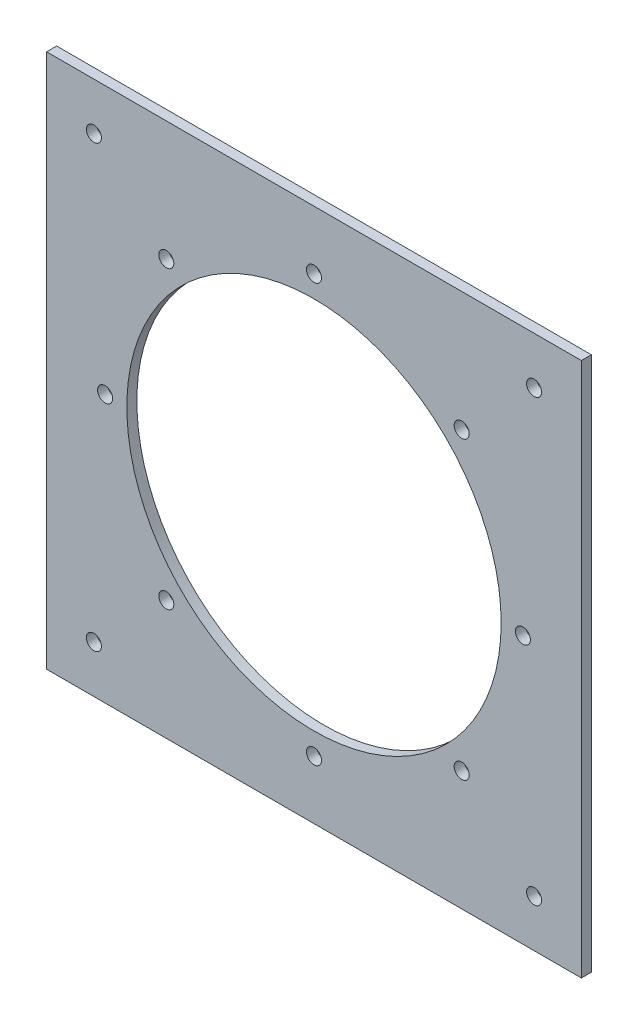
SolidWorks part; units mm, degrees
ref_plane "Plan de face" through (0, 0, 0) normal (0, 0, 1) x (1, 0, 0)
ref_plane "Plan de dessus" through (0, 0, 0) normal (0, 1, 0) x (1, 0, 0)
ref_plane "Plan de droite" through (0, 0, 0) normal (1, 0, 0) x (0, 0, -1)
sketch "Esquisse1" plane through (0, 0, 0) normal (0, 0, 1) x (1, 0, 0)
  line L1 (80, -80) -> (-80, -80)
  line L2 (80, -80) -> (80, 80)
  line L3 (80, 80) -> (-80, 80)
  line L4 (-80, -80) -> (-80, 80)
  line L5 (80, -80) -> (-80, 80) construction
  line L6 (80, 80) -> (-80, -80) construction
  circle A0 centre (0, 0) radius 80
  circle A1 centre (0, 0) radius 56
  dimension "D1" = 160
  dimension "D2" = 112
extrude "Boss.-Extru.1" add sketch "Esquisse1" along normal blind 3 contours A0 | A0 L2 L3 | A0 L3 L4 | A0 L4 L1 | A0 L1 L2
hole_wizard "M4 Clearance Hole1" positions "Sketch1" profile "Sketch2" hole size "M4" standard "ISO"
sketch "Sketch1" plane through (0, 0, 0) normal (0, 0, -1) x (-1, 0, 0)
  line L0 (0, 0) -> (-80, 80) construction
  line L1 (-80, -80) -> (-80, 80) construction
  point P0 (0, 62.5)
  point P16 (44.1942, 44.1942)
  point P17 (62.5, 0)
  point P18 (44.1942, -44.1942)
  point P19 (0, -62.5)
  point P20 (-44.1942, -44.1942)
  point P21 (-62.5, 0)
  point P22 (-44.1942, 44.1942)
  point P37 (-65.8579, 65.8579)
  point P43 (65.8579, 65.8579)
  point P44 (65.8579, -65.8579)
  point P45 (-65.8579, -65.8579)
  dimension "D1" = 62.5
  dimension "D3" = 20
  dimension "D2" = 8
  dimension "D4" = 4
sketch "Sketch2" plane through (0, 62.5, 0) normal (1, 0, 0) x (0, 1, 0)
  line L0 (0, 0) -> (0, 3)
  line L1 (0, 3) -> (2.25, 3)
  line L2 (2.25, 3) -> (2.25, 0)
  line L5 (2.25, 0) -> (0, 0)
  line L11 (0, -6.35) -> (0, 107.95) construction
  dimension "Thru Hole Dia." = 4.5
  dimension "Thru Hole Depth" = 3
